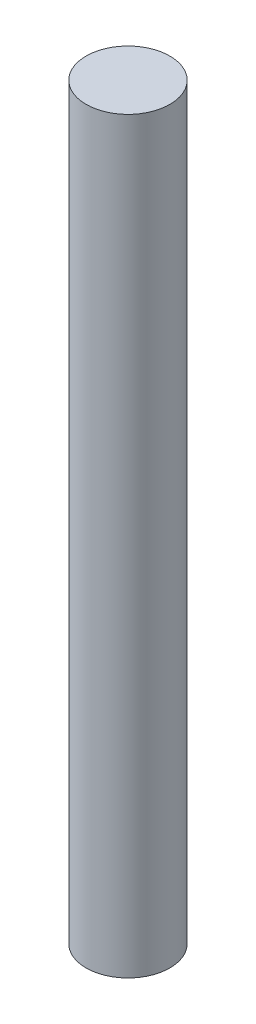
SolidWorks part; units mm, degrees
ref_plane "Front Plane" through (0, 0, 0) normal (0, 0, 1) x (1, 0, 0)
ref_plane "Top Plane" through (0, 0, 0) normal (0, 1, 0) x (1, 0, 0)
ref_plane "Right Plane" through (0, 0, 0) normal (1, 0, 0) x (0, 0, -1)
sketch "Sketch1" plane through (0, 0, 0) normal (0, 1, 0) x (1, 0, 0)
  circle A0 centre (0, 0) radius 1.4224
  dimension "D1" = 2.8448
extrude "Boss-Extrude1" add sketch "Sketch1" along normal blind 25.4
